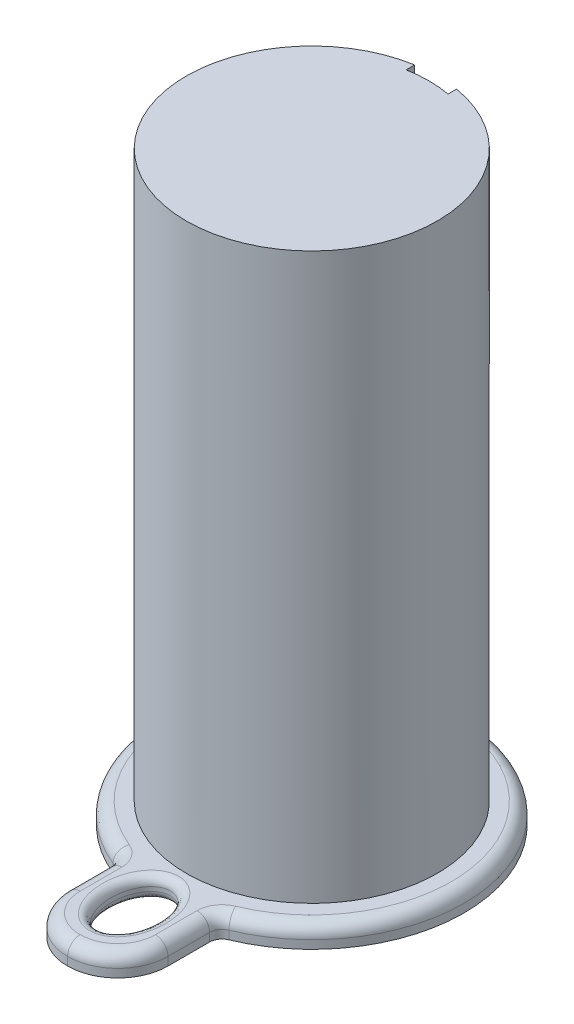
SolidWorks part; units mm, degrees
ref_plane "Front Plane" through (0, 0, 0) normal (0, 0, 1) x (1, 0, 0)
ref_plane "Top Plane" through (0, 0, 0) normal (0, 1, 0) x (1, 0, 0)
ref_plane "Right Plane" through (0, 0, 0) normal (1, 0, 0) x (0, 0, -1)
sketch "Sketch1" plane through (0, 0, 0) normal (0, 1, 0) x (1, 0, 0)
  circle A0 centre (0, 0) radius 38.1
extrude "Boss-Extrude1" add sketch "Sketch1" along normal blind 177.8
sketch "Sketch4" plane through (0, 0, 0) normal (0, 1, 0) x (1, 0, 0)
  line L2 (-15.24, -43.6308) -> (-15.24, -74.1108)
  line L3 (-15.24, -74.1108) -> (15.24, -74.1108)
  line L4 (15.24, -43.6308) -> (15.24, -74.1108)
  arc A0 (15.24, -43.6308) -> (-15.24, -43.6308) centre (0, 0) ccw
  point P7 (0, 0)
  point P8 (0, 0)
  point P9 (0, 0)
extrude "Boss-Extrude2" add sketch "Sketch4" along normal blind 6.35
sketch "Sketch3" plane through (0, 0, 0) normal (0, -1, 0) x (1, 0, 0)
  circle A0 centre (0, 0) radius 33.02
extrude "Cut-Extrude1" cut sketch "Sketch3" against normal blind 172.72
fillet "Fillet1" radius 3.81 7 edges at (0, 6.35, -46.2159) (15.24, 3.175, 43.6308) (0, 6.35, 74.1108) (15.24, 6.35, 58.8708) (-15.24, 3.175, 43.6308) (-15.24, 6.35, 58.8708) (0, 0, -33.02)
fillet "Fillet3" radius 15.24 4 edges at (-14.1241, 5.2341, 72.9949) (14.1241, 5.2341, 72.9949) (15.24, 1.27, 74.1108) (-15.24, 1.27, 74.1108)
sketch "Sketch5" plane through (0, 6.35, 0) normal (0, 1, 0) x (1, 0, 0)
  ellipse E0 centre (0, -53.9101) end of major axis (0.6734, -65.2581) minor radius 7.5164
extrude "Cut-Extrude2" cut sketch "Sketch5" against normal through all
fillet "Fillet4" radius 2.54 2 edges at (0.6734, 6.35, 65.2581) (0.6734, 0, 65.2581)
ref_plane "Plane1" through (0, 0, -38.1) normal (0, 0, -1) x (-1, 0, 0)
sketch "Sketch6" plane through (0, 0, -38.1) normal (0, 0, -1) x (-1, 0, 0)
  line L1 (-25.4, 12.7) -> (-6.35, 12.7)
  line L2 (-25.4, 12.7) -> (-25.4, 6.35)
  line L3 (-25.4, 6.35) -> (6.35, 6.35)
  line L4 (6.35, 12.7) -> (6.35, 6.35)
  line L6 (6.35, 12.7) -> (6.35, 38.1)
  line L7 (6.35, 38.1) -> (-6.35, 38.1)
  line L8 (-6.35, 12.7) -> (-6.35, 38.1)
extrude "Cut-Extrude3" cut sketch "Sketch6" against normal offset from surface (3.1116 mm away) 2.54
pattern_linear "LPattern2" count 7 spacing 25.4 along (0, 1, 0) of "Cut-Extrude3"
